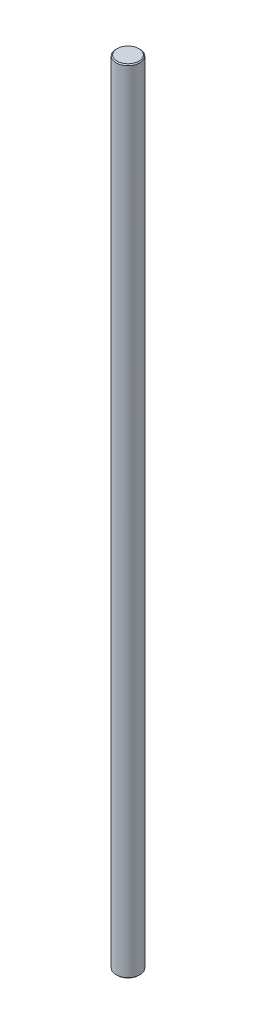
SolidWorks part; units mm, degrees
ref_plane "Спереди" through (0, 0, 0) normal (0, 0, 1) x (1, 0, 0)
ref_plane "Сверху" through (0, 0, 0) normal (0, 1, 0) x (1, 0, 0)
ref_plane "Справа" through (0, 0, 0) normal (1, 0, 0) x (0, 0, -1)
sketch "Эскиз1" plane through (0, 0, 0) normal (0, 0, 1) x (1, 0, 0)
  line L0 (-6, 0) -> (0, 0)
  line L1 (0, 0) -> (0, 400)
  line L2 (0, 400) -> (-6, 400)
  line L4 (-6, 400) -> (-6, 0)
  line L6 (0, 0) -> (0, 400) construction
  dimension "D1" = 400
  dimension "D2" = 6
revolve "Повернуть1" add sketch "Эскиз1" angle 360 about L6
chamfer "Фаска1" distance 0.5 angle 45 2 edges at (0, 0, 6) (0, 400, 6)
